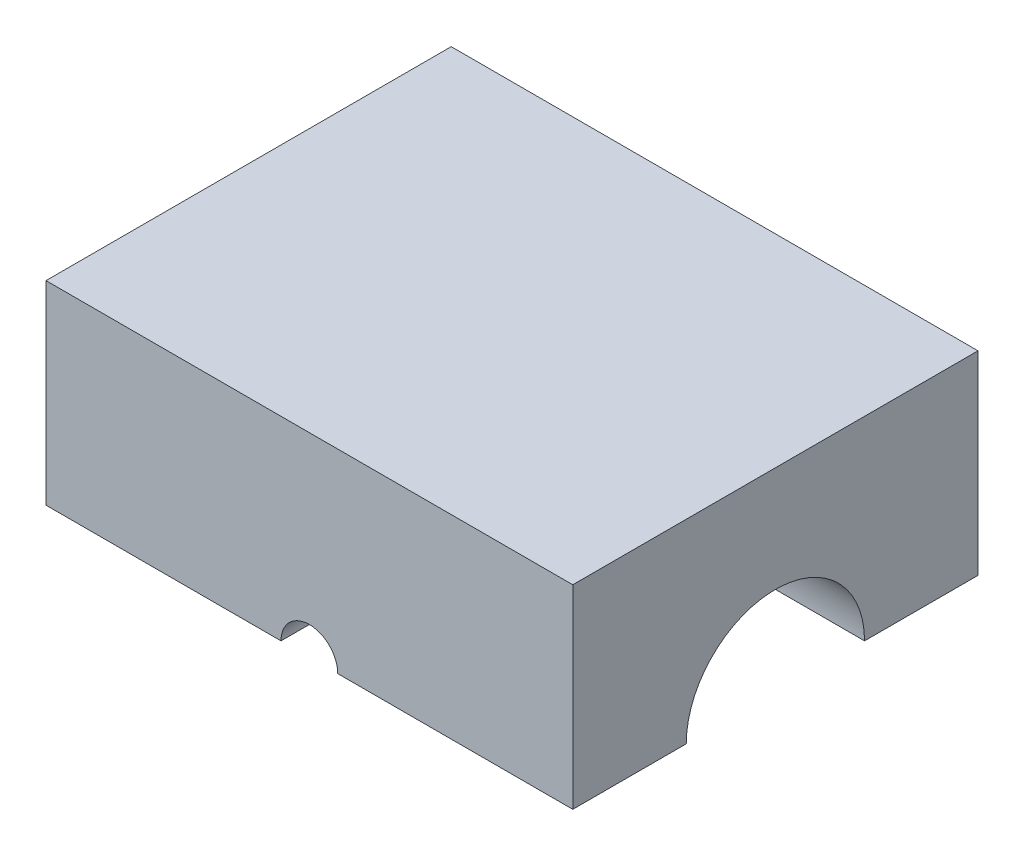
SolidWorks part; units mm, degrees
ref_plane "Front Plane" through (0, 0, 0) normal (0, 0, 1) x (1, 0, 0)
ref_plane "Top Plane" through (0, 0, 0) normal (0, 1, 0) x (1, 0, 0)
ref_plane "Right Plane" through (0, 0, 0) normal (1, 0, 0) x (0, 0, -1)
sketch "Sketch1" plane through (0, 0, 0) normal (0, 1, 0) x (1, 0, 0)
  line L0 (-206.375, 158.75) -> (206.375, -158.75) construction
  line L1 (-206.375, 158.75) -> (206.375, 158.75)
  line L2 (-206.375, 158.75) -> (-206.375, -158.75)
  line L3 (-206.375, -158.75) -> (206.375, -158.75)
  line L4 (206.375, 158.75) -> (206.375, -158.75)
  dimension "D1" = 412.75
  dimension "D2" = 317.5
extrude "Extrude1" add sketch "Sketch1" along normal blind 152.4
sketch "Sketch3" plane through (0, 0, 0) normal (0, -1, 0) x (1, 0, 0)
  line L0 (0, 158.75) -> (0, -158.75)
  line L1 (-206.375, 158.75) -> (206.375, 158.75) construction
  line L2 (206.375, -158.75) -> (-206.375, -158.75) construction
  line L3 (0, -158.75) -> (22.225, -158.75)
  line L4 (22.225, -158.75) -> (22.225, -101.6)
  line L5 (22.225, -101.6) -> (88.9, -101.6)
  line L6 (88.9, -101.6) -> (88.9, 101.6)
  line L7 (88.9, 101.6) -> (22.225, 101.6)
  line L8 (22.225, 101.6) -> (22.225, 158.75)
  line L9 (22.225, 158.75) -> (0, 158.75)
  dimension "D1" = 88.9
  dimension "D2" = 57.15
  dimension "D3" = 22.225
revolve "Cut-Revolve1" cut sketch "Sketch3" angle 360 about L0
sketch "Sketch4" plane through (0, 0, 0) normal (1, 0, 0) x (0, 0, -1)
  circle A0 centre (0, 0) radius 69.85
  dimension "D1" = 139.7
extrude "Extrude2" cut sketch "Sketch4" against normal through all and the other way through all
fillet "Fillet1" radius 25.4 2 edges at (55.2226, 69.6683, 5.0352) (-55.2226, 69.6683, -5.0352)
